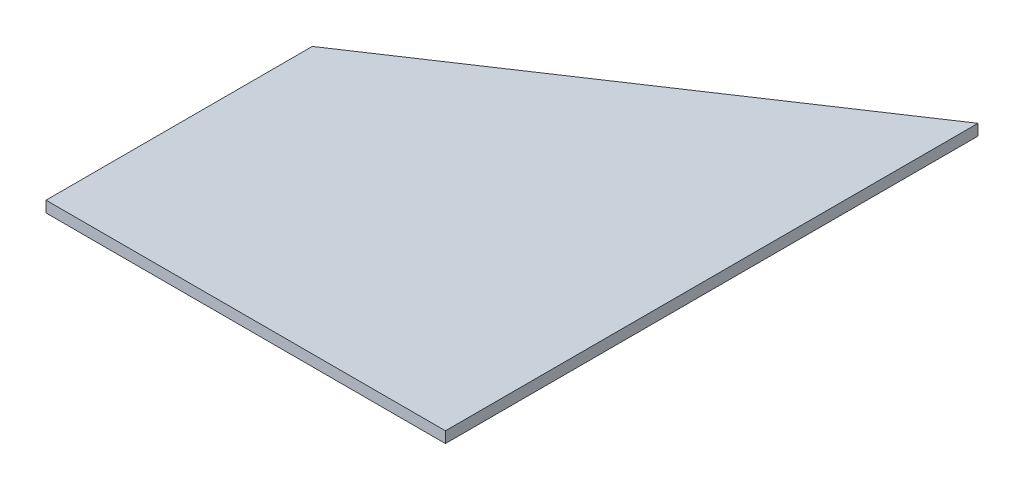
SolidWorks part; units mm, degrees
ref_plane "Front Plane" through (0, 0, 0) normal (1, 0, 0) x (0, 1, 0)
ref_plane "Top Plane" through (0, 0, 0) normal (0, 0, 1) x (0, 1, 0)
ref_plane "Right Plane" through (0, 0, 0) normal (0, 1, 0) x (-1, 0, 0)
sketch "Sketch1" plane through (0, 0, 0) normal (1, 0, 0) x (0, 1, 0)
  line L1 (76.2, -76.2) -> (82.55, -76.2)
  line L2 (76.2, -76.2) -> (76.2, 76.2)
  line L3 (76.2, 76.2) -> (82.55, 76.2)
  line L4 (82.55, -76.2) -> (82.55, 76.2)
ref_plane "Plane1" through (304.8, 0, 0) normal (1, 0, 0) x (0, 1, 0)
sketch "Sketch2" plane through (304.8, 0, 0) normal (1, 0, 0) x (0, 1, 0)
  line L1 (152.4, -152.4) -> (158.75, -152.4)
  line L2 (152.4, -152.4) -> (152.4, 152.4)
  line L3 (152.4, 152.4) -> (158.75, 152.4)
  line L4 (158.75, -152.4) -> (158.75, 152.4)
loft "Tapered_plywood_panel" add profiles "Sketch1", "Sketch2"
